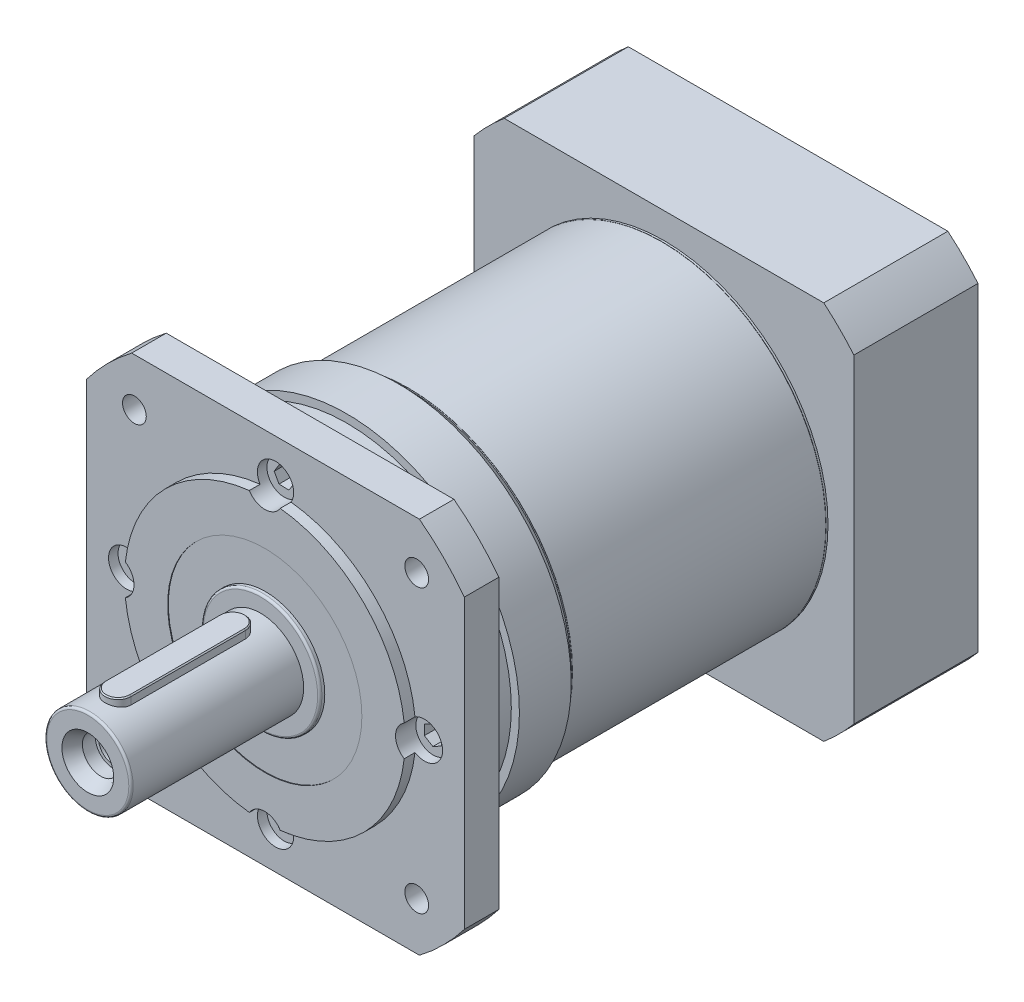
SolidWorks part; units mm, degrees
ref_plane "前视基准面" through (0, 0, 0) normal (0, 0, 1) x (1, 0, 0)
ref_plane "上视基准面" through (0, 0, 0) normal (0, 1, 0) x (1, 0, 0)
ref_plane "右视基准面" through (0, 0, 0) normal (1, 0, 0) x (0, 0, -1)
sketch "草图1" plane through (0, 0, 0) normal (0, 0, 1) x (1, 0, 0)
  circle A0 centre (0, 0) radius 80
extrude "凸台-拉伸1" add sketch "草图1" along normal blind 61.5
sketch "草图2" plane through (0, 0, 61.5) normal (0, 0, 1) x (1, 0, 0)
  circle A0 centre (0, 0) radius 65
extrude "凸台-拉伸2" add sketch "草图2" along normal blind 5
sketch "草图3" plane through (0, 0, 0) normal (0, 0, -1) x (-1, 0, 0)
  circle A0 centre (0, 0) radius 76
extrude "切除-拉伸1" cut sketch "草图3" against normal blind 0.5 flip side to cut
chamfer "倒角1" distance 4 angle 45 1 edges at (-80, 0, 0.5)
sketch "草图4" plane through (0, 0, 66.5) normal (0, 0, 1) x (1, 0, 0)
  line L0 (0, 0) -> (0, -69) construction
  circle A0 centre (0, 0) radius 69 construction
  circle A1 centre (0, -69) radius 8.4
extrude "切除-拉伸2" cut sketch "草图4" against normal blind 19
pattern_circular "阵列(圆周)1" count 4 over 360 about axis through (0, 0, 0) along (0, 0, 1) of "切除-拉伸2"
sketch "草图5" plane through (0, 0, 66.5) normal (0, 0, 1) x (1, 0, 0)
  circle A0 centre (0, 0) radius 27.5
extrude "凸台-拉伸3" add sketch "草图5" along normal blind 2
sketch "草图6" plane through (0, 0, 68.5) normal (0, 0, 1) x (1, 0, 0)
  circle A0 centre (0, 0) radius 20
extrude "凸台-拉伸4" add sketch "草图6" along normal blind 80
fillet "圆角1" radius 1 1 edges at (20, 0, 148.5)
fillet "圆角2" radius 1 1 edges at (27.5, 0, 68.5)
sketch "草图7" plane through (0, 0, 66.5) normal (0, 0, 1) x (1, 0, 0)
  circle A0 centre (0, 0) radius 45
  circle A1 centre (0, 0) radius 27.5
extrude "切除-拉伸3" cut sketch "草图7" against normal blind 0.3
ref_plane "基准面1" through (0, 0, -0.1) normal (0, 0, -1) x (-1, 0, 0)
sketch "草图8" plane through (0, 0, 61.5) normal (0, 0, 1) x (1, 0, 0)
  line L0 (0, 0) -> (0, 72.5)
  line L1 (0, 0) -> (-51.2652, 51.2652)
  circle A0 centre (0, 0) radius 72.5
  dimension "D1" = 45
sketch "草图10" plane through (0, 0, -0.1) normal (0, 0, -1) x (-1, 0, 0)
  circle A0 centre (0, 0) radius 76
extrude "凸台-拉伸5" add sketch "草图10" along normal blind 117.4 separate body
ref_plane "基准面2" through (0, 0, -117.6) normal (0, 0, -1) x (-1, 0, 0)
sketch "草图11" plane through (0, 0, -117.6) normal (0, 0, -1) x (-1, 0, 0)
  circle A0 centre (0, 0) radius 76
extrude "凸台-拉伸6" add sketch "草图11" along normal blind 0.9 separate body
sketch "草图12" plane through (0, 0, -118.5) normal (0, 0, -1) x (-1, 0, 0)
  line L1 (-74.0338, 88) -> (74.0338, 88)
  line L2 (-88, 74.0338) -> (-88, -74.0338)
  line L3 (-74.0338, -88) -> (74.0338, -88)
  line L4 (88, 74.0338) -> (88, -74.0338)
  arc A0 (-74.0338, 88) -> (-88, 74.0338) centre (0, 0) ccw
  arc A1 (-88, -74.0338) -> (-74.0338, -88) centre (0, 0) ccw
  arc A2 (74.0338, -88) -> (88, -74.0338) centre (0, 0) ccw
  arc A3 (88, 74.0338) -> (74.0338, 88) centre (0, 0) ccw
  dimension "D1" = 88
  dimension "D3" = 88
extrude "凸台-拉伸7" add sketch "草图12" along normal blind 57.5
sketch "草图13" plane through (0, 0, -176) normal (0, 0, -1) x (-1, 0, 0)
  circle A0 centre (0, 0) radius 57.15
extrude "切除-拉伸4" cut sketch "草图13" against normal blind 7
sketch "草图14" plane through (0, 0, -169) normal (0, 0, -1) x (-1, 0, 0)
  circle A0 centre (0, 0) radius 55
extrude "切除-拉伸5" cut sketch "草图14" against normal blind 25
sketch "草图15" plane through (0, 0, -144) normal (0, 0, -1) x (-1, 0, 0)
  circle A0 centre (0, 0) radius 50
extrude "切除-拉伸6" cut sketch "草图15" against normal blind 30.5
sketch "草图16" plane through (0, 0, -176) normal (0, 0, -1) x (-1, 0, 0)
  line L0 (0, 0) -> (0, -67.5) construction
  circle A0 centre (0, 0) radius 67.5 construction
  circle A1 centre (0, -67.5) radius 7
extrude "切除-拉伸7" cut sketch "草图16" against normal blind 11
pattern_circular "阵列(圆周)3" count 4 over 360 about axis through (0, 0, 0) along (0, 0, 1) of "切除-拉伸7"
sketch "草图17" plane through (0, 0, -176) normal (0, 0, -1) x (-1, 0, 0)
  line L0 (0, 0) -> (-81.3173, 81.3173)
  circle A0 centre (0, 0) radius 100
  arc A1 (-74.0338, 88) -> (-88, 74.0338) centre (0, 0) ccw construction
hole_wizard "M8 螺纹孔1" positions "3D草图2" profile "草图18" tap size "M8" standard "GB"
sketch3d "3D草图2"
  line L0 (0, 0, -176) -> (81.3173, 81.3173, -176) construction
  circle A0 centre (0, 0, -176) radius 100 construction
  point P0 (70.7107, 70.7107, -176)
  point P6 (0, 0, -276)
sketch "草图18" plane through (70.7107, 70.7107, -176) normal (1, 0, 0) x (0, 1, 0)
  line L0 (0, 0) -> (0, 31.0429)
  line L1 (0, 31.0429) -> (3.4, 29)
  line L2 (3.4, 29) -> (3.4, 0)
  line L5 (3.4, 0) -> (0, 0)
  line L10 (0, 31.0429) -> (-3.4, 29) construction
  line L11 (0, -6.35) -> (0, 107.95) construction
  dimension "螺纹孔钻头直径" = 6.8
  dimension "螺纹孔钻头深度" = 29
  dimension "导头角度" = 118
pattern_circular "阵列(圆周)4" count 4 over 360 about axis through (0, 0, 0) along (0, 0, 1) of "M8 螺纹孔1"
sketch "草图19" plane through (0, 0, 47.5) normal (0, 0, 1) x (1, 0, 0)
  line L1 (2.4055, 72.943) -> (-2.212, 73.0547)
  line L2 (-2.212, 73.0547) -> (-4.6175, 69.1117)
  line L3 (-4.6175, 69.1117) -> (-2.4055, 65.057)
  line L4 (-2.4055, 65.057) -> (2.212, 64.9453)
  line L5 (2.212, 64.9453) -> (4.6175, 68.8883)
  line L6 (4.6175, 68.8883) -> (2.4055, 72.943)
  circle A0 centre (0, 69) radius 8
  circle A1 centre (0, 69) radius 4 construction
  dimension "D1" = 8
extrude "凸台-拉伸8" add sketch "草图19" along normal blind 10
pattern_circular "阵列(圆周)5" count 4 over 360 about axis through (0, 0, 0) along (0, 0, 1) of "凸台-拉伸8"
sketch "草图20" plane through (0, 0, -165) normal (0, 0, -1) x (-1, 0, 0)
  line L1 (1.7033, 70.5164) -> (-1.7607, 70.4833)
  line L2 (-1.7607, 70.4833) -> (-3.4639, 67.4669)
  line L3 (-3.4639, 67.4669) -> (-1.7033, 64.4836)
  line L4 (-1.7033, 64.4836) -> (1.7607, 64.5167)
  line L5 (1.7607, 64.5167) -> (3.4639, 67.5331)
  line L6 (3.4639, 67.5331) -> (1.7033, 70.5164)
  circle A0 centre (0, 67.5) radius 6.5
  circle A1 centre (0, 67.5) radius 3 construction
  dimension "D1" = 6
extrude "凸台-拉伸9" add sketch "草图20" along normal blind 8
pattern_circular "阵列(圆周)6" count 4 over 360 about axis through (0, 0, 0) along (0, 0, 1) of "凸台-拉伸9"
ref_plane "基准面3" through (0, 0, -143) normal (0, 0, -1) x (-1, 0, 0)
sketch "草图21" plane through (0, 0, -143) normal (0, 0, -1) x (-1, 0, 0)
  circle A0 centre (0, 0) radius 37.5
extrude "凸台-拉伸10" add sketch "草图21" against normal up to surface (29.5 mm away)
chamfer "倒角2" distance 1.5 angle 45 1 edges at (-37.5, 0, -143)
sketch "草图22" plane through (0, 0, -176) normal (0, 0, -1) x (-1, 0, 0)
  circle A0 centre (0, 0) radius 17.5
extrude "切除-拉伸8" cut sketch "草图22" against normal blind 86
sketch "草图23" plane through (0, 0, -143) normal (0, 0, -1) x (-1, 0, 0)
  line L1 (-43.0001, 0.5) -> (42.7283, 0.5)
  line L2 (-43.0001, 0.5) -> (-43.0001, -0.5)
  line L3 (-43.0001, -0.5) -> (42.7283, -0.5)
  line L4 (42.7283, 0.5) -> (42.7283, -0.5)
  dimension "D1" = 0.5
  dimension "D2" = 1
extrude "切除-拉伸9" cut sketch "草图23" against normal up to surface (29.5 mm away)
sketch "草图24" plane through (0, 0, 0) normal (0, 1, 0) x (1, 0, 0)
  line L0 (-6, -134.5) -> (-6, -81.5)
  line L1 (6, -134.5) -> (6, -81.5)
  line L2 (-19, -148.5) -> (19, -148.5) construction
  arc A0 (-6, -134.5) -> (6, -134.5) centre (0, -134.5) ccw
  arc A1 (6, -81.5) -> (-6, -81.5) centre (0, -81.5) ccw
  dimension "D1" = 14
  dimension "D2" = 53
extrude "凸台-拉伸11" add sketch "草图24" along normal blind 23
chamfer "倒角3" distance 0.5 angle 45 4 edges at (6, 23, 108) (0, 23, 75.5) (0, 23, 140.5) (-6, 23, 108)
sketch "草图25" plane through (0, 0, 61.5) normal (0, 0, 1) x (1, 0, 0)
  line L1 (-66.6615, 87.5) -> (66.6615, 87.5)
  line L2 (-87.5, 66.6615) -> (-87.5, -66.6615)
  line L3 (-66.6615, -87.5) -> (66.6615, -87.5)
  line L4 (87.5, 66.6615) -> (87.5, -66.6615)
  arc A0 (-66.6615, 87.5) -> (-87.5, 66.6615) centre (0, 0) ccw
  arc A1 (-87.5, -66.6615) -> (-66.6615, -87.5) centre (0, 0) ccw
  arc A2 (66.6615, -87.5) -> (87.5, -66.6615) centre (0, 0) ccw
  arc A3 (87.5, 66.6615) -> (66.6615, 87.5) centre (0, 0) ccw
  arc A4 (-4.4577, 76.1196) -> (-76.1196, 4.4577) centre (0, 0) ccw
  arc A5 (7.1583, 64.6046) -> (-7.1583, 64.6046) centre (0, 69) ccw construction
  arc A6 (4.4577, 76.1196) -> (-4.4577, 76.1196) centre (0, 69) ccw
  arc A7 (64.6046, -7.1583) -> (64.6046, 7.1583) centre (69, 0) ccw construction
  circle A8 centre (0, -69) radius 8.4 construction
  arc A9 (-64.6046, 7.1583) -> (-64.6046, -7.1583) centre (-69, 0) ccw construction
  arc A10 (76.1196, -4.4577) -> (76.1196, 4.4577) centre (69, 0) ccw
  arc A11 (-4.4577, -76.1196) -> (4.4577, -76.1196) centre (0, -69) ccw
  arc A12 (-76.1196, 4.4577) -> (-76.1196, -4.4577) centre (-69, 0) ccw
  arc A13 (-76.1196, -4.4577) -> (-4.4577, -76.1196) centre (0, 0) ccw
  arc A14 (4.4577, -76.1196) -> (76.1196, -4.4577) centre (0, 0) ccw
  arc A15 (76.1196, 4.4577) -> (4.4577, 76.1196) centre (0, 0) ccw
  dimension "D1" = 87.5
  dimension "D3" = 87.5
extrude "凸台-拉伸12" add sketch "草图25" against normal blind 16
sketch "草图26" plane through (0, 0, 45.5) normal (0, 0, -1) x (-1, 0, 0)
  circle A0 centre (0, 0) radius 76.25
extrude "切除-拉伸10" cut sketch "草图26" along normal blind 17 flip side to cut
sketch "草图28" plane through (0, 0, 61.5) normal (0, 0, 1) x (1, 0, 0)
  line L0 (0, 0) -> (-77.7817, 77.7817) construction
  circle A0 centre (0, 0) radius 92.5 construction
  arc A1 (-66.6615, 87.5) -> (-87.5, 66.6615) centre (0, 0) ccw construction
  circle A2 centre (-65.4074, 65.4074) radius 5.5
extrude "切除-拉伸11" cut sketch "草图28" against normal blind 17
pattern_circular "阵列(圆周)7" count 4 over 360 about axis through (0, 0, 0) along (0, 0, 1) of "切除-拉伸11"
sketch "草图29" plane through (0, 0, 148.5) normal (0, 0, 1) x (1, 0, 0)
  circle A0 centre (0, 0) radius 8.5
extrude "切除-拉伸12" cut sketch "草图29" against normal blind 12
ref_plane "基准面4" through (0, 0, 142.5) normal (0, 0, 1) x (1, 0, 0)
sketch "草图31" plane through (0, 0, 148.5) normal (0, 0, 1) x (1, 0, 0)
  circle A0 centre (0, 0) radius 12
sketch "草图32" plane through (0, 0, 142.5) normal (0, 0, 1) x (1, 0, 0)
  circle A0 centre (0, 0) radius 8.5 construction
  circle A1 centre (0, 0) radius 8.5
loft "切除-放样1" cut profiles "草图32", "草图31"
hole_wizard "M16 螺纹孔1" positions "3D草图3" profile "草图33" tap size "M16" standard "GB"
sketch3d "3D草图3"
  line L0 (0, 0, 136.5) -> (0, 0, 142.5) construction
  point P0 (0, 0, 136.5)
sketch "草图33" plane through (0, 0, 136.5) normal (1, 0, 0) x (0, -1, 0)
  line L0 (0, 0) -> (0, 38.206)
  line L1 (0, 38.206) -> (7, 34)
  line L2 (7, 34) -> (7, 0)
  line L5 (7, 0) -> (0, 0)
  line L10 (0, 38.206) -> (-7, 34) construction
  line L11 (0, -6.35) -> (0, 107.95) construction
  dimension "螺纹孔钻头直径" = 14
  dimension "螺纹孔钻头深度" = 34
  dimension "导头角度" = 118
